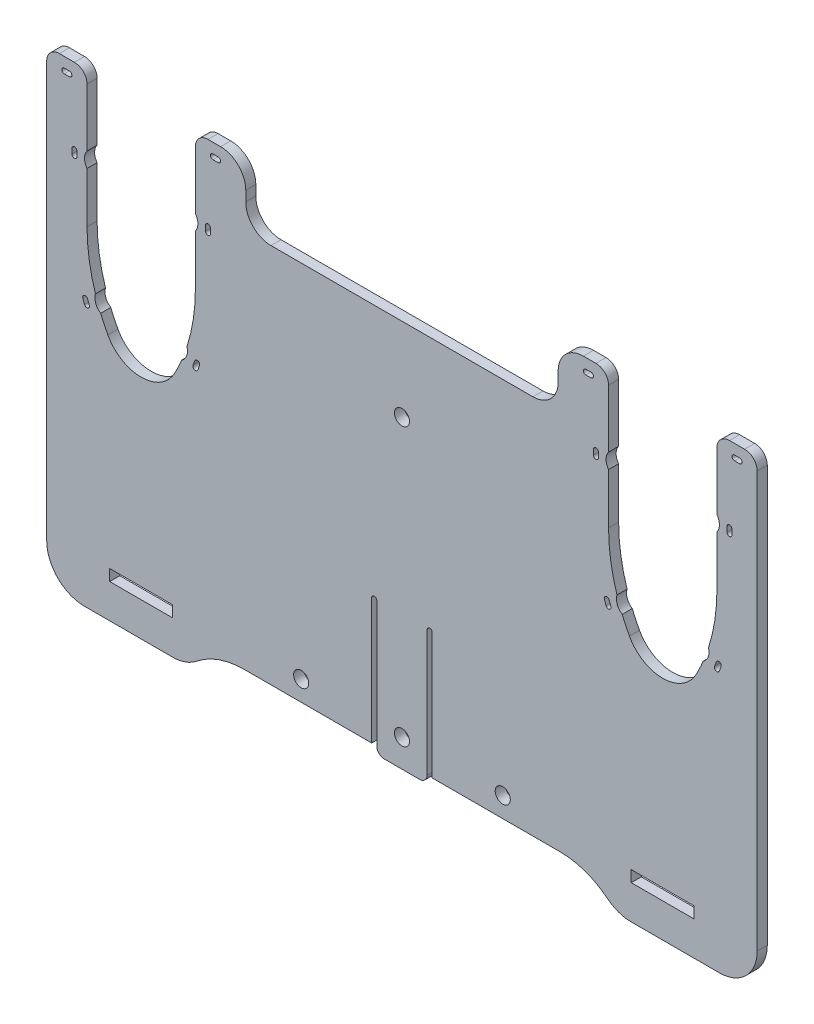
SolidWorks part; units mm, degrees
ref_plane "Front Plane" through (0, 0, 0) normal (0, 0, 1) x (1, 0, 0)
ref_plane "Top Plane" through (0, 0, 0) normal (0, 1, 0) x (1, 0, 0)
ref_plane "Right Plane" through (0, 0, 0) normal (1, 0, 0) x (0, 0, -1)
sketch "Sketch1" plane through (0, 0, 0) normal (0, 0, 1) x (1, 0, 0)
  line L0 (0, 0) -> (0, 5)
  line L1 (0, 151) -> (52, 151)
  line L2 (130, 175) -> (136, 175)
  line L3 (0, 0) -> (0, 3) construction
  line L4 (141, 170) -> (141, 5)
  line L5 (-55, 153) -> (55, 153) construction
  line L6 (-55, 153) -> (-55, 3) construction
  line L7 (-55, 3) -> (55, 3) construction
  line L8 (55, 153) -> (55, 3) construction
  line L9 (0, 0) -> (0, -10) construction
  line L10 (82, 170) -> (82, 147)
  line L11 (0, 121) -> (0, 151)
  line L12 (125, 170) -> (125, 147)
  line L13 (0, 0) -> (10, 0) construction
  line L14 (91, -10) -> (126, -10)
  line L15 (103.5, 95) -> (103.5, 80) construction
  line L16 (62, 161) -> (62, 165)
  line L17 (0, 73) -> (35, 73) construction
  line L18 (72, 175) -> (77, 175)
  line L19 (77, 144) -> (130, 144) construction
  line L20 (130, 143) -> (130, 145) construction
  line L21 (129, 143) -> (129, 145)
  line L22 (131, 143) -> (131, 145)
  line L23 (77, 143) -> (77, 145) construction
  line L24 (76, 143) -> (76, 145)
  line L25 (78, 143) -> (78, 145)
  line L26 (81.9736, 94.0617) -> (81.2819, 95.9383) construction
  line L27 (81.0353, 93.7159) -> (80.3436, 95.5925)
  line L28 (82.9119, 94.4075) -> (82.2202, 96.2841)
  line L29 (125.0264, 94.0617) -> (125.7181, 95.9383) construction
  line L30 (124.0881, 94.4075) -> (124.7798, 96.2841)
  line L31 (125.9647, 93.7159) -> (126.6564, 95.5925)
  line L32 (75, 170) -> (73, 170) construction
  line L33 (75, 169) -> (73, 169)
  line L34 (75, 171) -> (73, 171)
  line L35 (132, 170) -> (134, 170) construction
  line L36 (132, 171) -> (134, 171)
  line L37 (132, 169) -> (134, 169)
  line L38 (125.3722, 95) -> (81.6278, 95) construction
  line L39 (132, 170) -> (75, 170) construction
  line L40 (103.5, 170) -> (103.5, 144) construction
  line L41 (103.5, 144) -> (103.5, 95) construction
  line L42 (133, 175) -> (133, 170) construction
  line L43 (81.9736, 94.0617) -> (103.5, 94.0617) construction
  line L44 (86.3193, 96.7292) -> (82.5661, 95.3458) construction
  line L45 (125.0264, 94.0617) -> (103.5, 94.0617) construction
  line L46 (90.1328, 98.1347) -> (103.5, 98.1347) construction
  line L47 (103.5, 98.1347) -> (116.8672, 98.1347) construction
  line L48 (125, 141) -> (125, 120.9374)
  line L49 (82, 141) -> (82, 120.9374)
  line L50 (103.5, 8) -> (103.5, 80) construction
  line L51 (91, 8) -> (116, 8)
  line L52 (91, 8) -> (91, 3.5)
  line L53 (91, 3.5) -> (116, 3.5)
  line L54 (116, 8) -> (116, 3.5)
  line L55 (0, 11) -> (0, 115)
  line L56 (12, 0) -> (62.7157, 0)
  line L57 (7, -3) -> (0, -3)
  line L58 (10, 0) -> (10, 50)
  line L59 (0, -3) -> (0, 0)
  line L60 (12, 0) -> (12, 50)
  arc A0 (116.7273, 87.9262) -> (90.2727, 87.9262) centre (103.5, 95) cw
  arc A1 (130, 175) -> (125, 170) centre (130, 170) ccw
  arc A2 (77, 175) -> (82, 170) centre (77, 170) cw
  arc A3 (141, 170) -> (136, 175) centre (136, 170) ccw
  arc A4 (126, -10) -> (141, 5) centre (126, 5) ccw
  arc A5 (91, -10) -> (81.5719, -6.6667) centre (91, 5) cw
  arc A6 (81.5719, -6.6667) -> (62.7157, 0) centre (62.7157, -30) ccw
  arc A7 (0, 115) -> (0, 121) centre (0, 118) ccw
  circle A8 centre (40, 8) radius 3
  arc A9 (72, 175) -> (62, 165) centre (72, 165) ccw
  arc A10 (52, 151) -> (62, 161) centre (52, 161) ccw
  arc A11 (116.7273, 87.9262) -> (119.5829, 93.9365) centre (55, 120.9374) ccw
  arc A12 (90.2727, 87.9262) -> (87.4171, 93.9365) centre (152, 120.9374) cw
  arc A13 (129, 143) -> (131, 143) centre (130, 143) ccw
  arc A14 (131, 145) -> (129, 145) centre (130, 145) ccw
  arc A15 (76, 143) -> (78, 143) centre (77, 143) ccw
  arc A16 (78, 145) -> (76, 145) centre (77, 145) ccw
  arc A17 (81.0353, 93.7159) -> (82.9119, 94.4075) centre (81.9736, 94.0617) ccw
  arc A18 (82.2202, 96.2841) -> (80.3436, 95.5925) centre (81.2819, 95.9383) ccw
  arc A19 (124.0881, 94.4075) -> (125.9647, 93.7159) centre (125.0264, 94.0617) ccw
  arc A20 (126.6564, 95.5925) -> (124.7798, 96.2841) centre (125.7181, 95.9383) ccw
  arc A21 (75, 169) -> (75, 171) centre (75, 170) ccw
  arc A22 (73, 171) -> (73, 169) centre (73, 170) ccw
  arc A23 (132, 171) -> (132, 169) centre (132, 170) ccw
  arc A24 (134, 169) -> (134, 171) centre (134, 170) ccw
  arc A25 (125, 141) -> (125, 147) centre (121, 144) ccw
  arc A26 (82, 147) -> (82, 141) centre (86, 144) ccw
  arc A27 (85.3421, 99.5663) -> (87.4171, 93.9365) centre (90.1328, 98.1347) ccw
  arc A28 (119.5829, 93.9365) -> (121.6579, 99.5663) centre (116.8672, 98.1347) ccw
  arc A29 (121.6579, 99.5663) -> (125, 120.9374) centre (55, 120.9374) ccw
  arc A30 (85.3421, 99.5663) -> (82, 120.9374) centre (152, 120.9374) cw
  arc A31 (0, 5) -> (0, 11) centre (0, 8) ccw
  arc A32 (10, 50) -> (12, 50) centre (11, 50) cw
  arc A33 (10, 0) -> (7, -3) centre (7, 0) cw
  point P51 (130, 144)
  point P57 (77, 144)
  point P65 (81.6278, 95)
  point P71 (125.3722, 95)
  point P78 (74, 170)
  point P85 (133, 170)
  dimension "D1" = 5
  dimension "D2" = 5
  dimension "D3" = 15
  dimension "D9" = 15
  dimension "D10" = 30
  dimension "D13" = 6
  dimension "D16" = 8
  dimension "D17" = 50
  dimension "D20" = 90
  dimension "D22" = 10
  dimension "D24" = 10
  dimension "D25" = 15
  dimension "D26" = 70
  dimension "D27" = 2
  dimension "D35" = 10
  dimension "D43" = 6
  dimension "D4" = 16
  dimension "D5" = 43
  dimension "D6" = 27
  dimension "D7" = 110
  dimension "D8" = 150
  dimension "D11" = 10
  dimension "D12" = 282
  dimension "D14" = 110
  dimension "D15" = 80
  dimension "D18" = 5
  dimension "D19" = 2
  dimension "D21" = 185
  dimension "D23" = 52
  dimension "D28" = 35
  dimension "D29" = 73
  dimension "D30" = 2
  dimension "D31" = 4
  dimension "D32" = 4
  dimension "D33" = 4
  dimension "D34" = 26
  dimension "D36" = 6
  dimension "D37" = 6
  dimension "D38" = 4.5
  dimension "D39" = 25
  dimension "D40" = 90
  dimension "D41" = 72
  dimension "D42" = 18
  dimension "D44" = 2
  dimension "D45" = 10
  dimension "D46" = 50
  dimension "D47" = 3
extrude "Extrude1" add sketch "Sketch1" along normal blind 4
mirror "Mirror1" about plane through (0, 0, 0) normal (1, 0, 0) of "Extrude1"
ref_plane "Plane1" through (103.5, 0, 0) normal (1, 0, 0) x (0, 0, -1)
